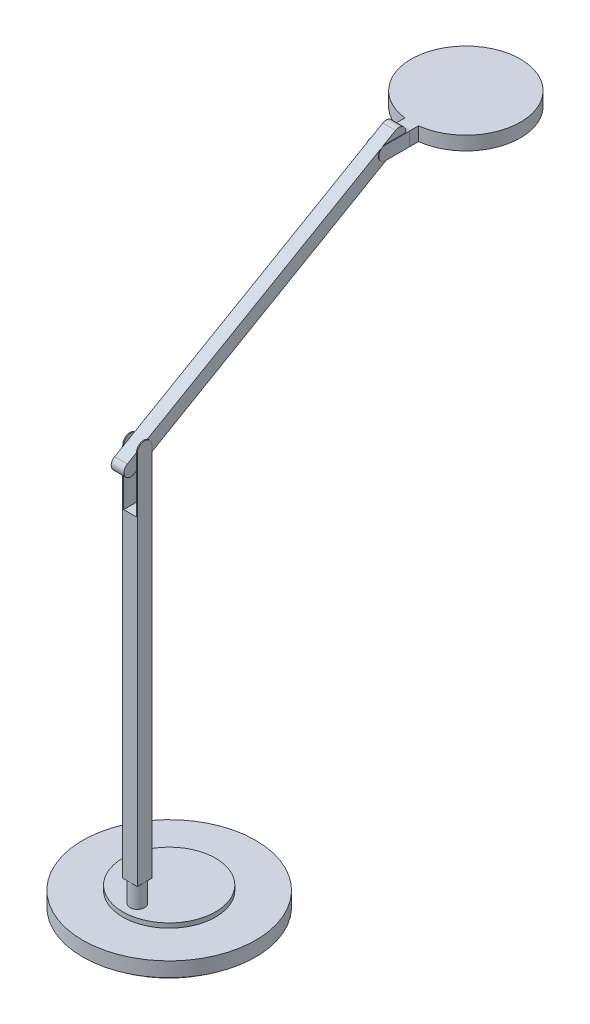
SolidWorks part; units mm, degrees
ref_plane "Alzado" through (0, 0, 0) normal (0, 0, 1) x (1, 0, 0)
ref_plane "Planta" through (0, 0, 0) normal (0, 1, 0) x (1, 0, 0)
ref_plane "Vista lateral" through (0, 0, 0) normal (1, 0, 0) x (0, 0, -1)
sketch "Croquis1" plane through (0, 0, 0) normal (0, 1, 0) x (1, 0, 0)
  circle A0 centre (0, 0) radius 87
  dimension "D1" = 174
ref_plane "Plano1" through (0, 6, 0) normal (0, 1, 0) x (1, 0, 0)
sketch "Croquis2" plane through (0, 6, 0) normal (0, 1, 0) x (1, 0, 0)
  circle A0 centre (0, 0) radius 95
  dimension "D1" = 190
loft "Recubrir1" add profiles "Croquis1", "Croquis2"
sketch "Croquis3" plane through (0, 6, 0) normal (0, 1, 0) x (1, 0, 0)
  circle A0 centre (0, 0) radius 95
extrude "Saliente-Extruir1" add sketch "Croquis3" along normal blind 16
sketch "Croquis4" plane through (0, 22, 0) normal (0, 1, 0) x (1, 0, 0)
  circle A0 centre (0, 0) radius 51
  dimension "D1" = 102
extrude "Saliente-Extruir2" add sketch "Croquis4" along normal blind 5
sketch "Croquis5" plane through (0, 27, 0) normal (0, 1, 0) x (1, 0, 0)
  line L0 (0, -51) -> (0, -41) construction
  circle A0 centre (0, 0) radius 51 construction
  circle A1 centre (0, 0) radius 51 construction
  circle A3 centre (0, -35) radius 6
  circle A4 centre (0, -35) radius 8
  dimension "D1" = 2
extrude "Saliente-Extruir3" add sketch "Croquis5" along normal blind 24
sketch "Croquis6" plane through (0, 51, 0) normal (0, 1, 0) x (1, 0, 0)
  line L0 (0, -27) -> (8, -27)
  line L1 (8, -27) -> (8, -43)
  line L2 (8, -43) -> (-8, -43)
  line L3 (-8, -43) -> (-8, -27)
  line L4 (-8, -27) -> (0, -27)
  circle A0 centre (0, -35) radius 8 construction
  circle A1 centre (0, -35) radius 8 construction
extrude "Saliente-Extruir4" add sketch "Croquis6" along normal blind 420
sketch "Croquis7" plane through (0, 471, 0) normal (0, 1, 0) x (1, 0, 0)
  line L9 (-8, -27) -> (-7, -27) construction
  line L10 (8, -27) -> (-8, -27) construction
  line L11 (-7, -27) -> (-7, -43)
  line L12 (-8, -43) -> (8, -43) construction
  line L13 (8, -43) -> (7, -43) construction
  line L14 (7, -43) -> (7, -27)
  line L15 (7, -27) -> (-7, -27)
  line L16 (-7, -43) -> (7, -43)
extrude "Cortar-Extruir1" cut sketch "Croquis7" against normal blind 69
sketch "Croquis8" plane through (-8, 0, 0) normal (-1, 0, 0) x (0, 0, 1)
  line L0 (27, 471) -> (27, 51) construction
  line L1 (27, 471) -> (43, 471) construction
  line L2 (43, 471) -> (43, 51) construction
  line L3 (27, 463) -> (27, 471)
  line L4 (27, 471) -> (43, 471)
  line L5 (43, 471) -> (43, 463)
  arc A0 (43, 463) -> (27, 463) centre (35, 463) ccw
extrude "Cortar-Extruir2" cut sketch "Croquis8" against normal through all contours A0 L4 M6 | A0 M4 M5
sketch "Croquis10" plane through (0, 0, 0) normal (1, 0, 0) x (0, 0, -1)
  line L0 (-35, 471) -> (-35, 459)
  line L3 (-31.25, 452.5048) -> (-45.4063, 444.3317)
  line L4 (-31.25, 452.5048) -> (249.0424, 614.3317)
  line L5 (-38.75, 465.4952) -> (-52.9063, 457.3221)
  line L6 (-38.75, 465.4952) -> (241.5424, 627.3221)
  arc A0 (-27, 463) -> (-43, 463) centre (-35, 463) ccw construction
  arc A1 (-52.9063, 457.3221) -> (-45.4063, 444.3317) centre (-49.1563, 450.8269) ccw
  arc A2 (249.0424, 614.3317) -> (241.5424, 627.3221) centre (245.2924, 620.8269) ccw
extrude "Saliente-Extruir5" add sketch "Croquis10" along normal up to surface and the other way up to surface
sketch "Croquis11" plane through (0, 0, 0) normal (1, 0, 0) x (0, 0, -1)
  line L0 (251.7876, 624.5769) -> (-55.6514, 447.0769) construction
  line L1 (251.7876, 624.5769) -> (230.1369, 612.0769) construction
  line L2 (222.6369, 612.0769) -> (256.6369, 612.0769) construction
  line L3 (256.6369, 619.5769) -> (256.6369, 604.5769)
  line L4 (256.6369, 604.5769) -> (230.1369, 604.5769)
  line L5 (230.1369, 619.5769) -> (256.6369, 619.5769)
  arc A0 (249.0424, 614.3317) -> (241.5424, 627.3221) centre (245.2924, 620.8269) ccw construction
  arc A1 (-52.9063, 457.3221) -> (-45.4063, 444.3317) centre (-49.1563, 450.8269) ccw construction
  arc A2 (230.1369, 619.5769) -> (230.1369, 604.5769) centre (230.1369, 612.0769) ccw
  point P14 (256.6369, 612.0769)
  dimension "D1" = 34
extrude "Saliente-Extruir6" add sketch "Croquis11" along normal blind 7.5 and the other way blind 7.5
sketch "Croquis13" plane through (0, 619.5769, 0) normal (0, 1, 0) x (1, 0, 0)
  line L0 (-7.5, 256.6369) -> (7.5, 256.6369)
  line L1 (7.5, 256.6369) -> (7.5, 266.2156)
  line L3 (-7.5, 266.2156) -> (-7.5, 256.6369)
  arc A1 (7.5, 266.2156) -> (-7.5, 266.2156) centre (0, 325.745) ccw
  point P6 (0, 0)
extrude "Saliente-Extruir7" add sketch "Croquis13" against normal up to surface (15 mm away) separate body
sketch "Croquis14" plane through (0, 604.5769, 0) normal (0, -1, 0) x (1, 0, 0)
  circle A2 centre (0, -325.745) radius 48
  circle A3 centre (0, -325.745) radius 48
  dimension "D1" = 12
extrude "Cortar-Extruir3" cut sketch "Croquis14" against normal blind 2
